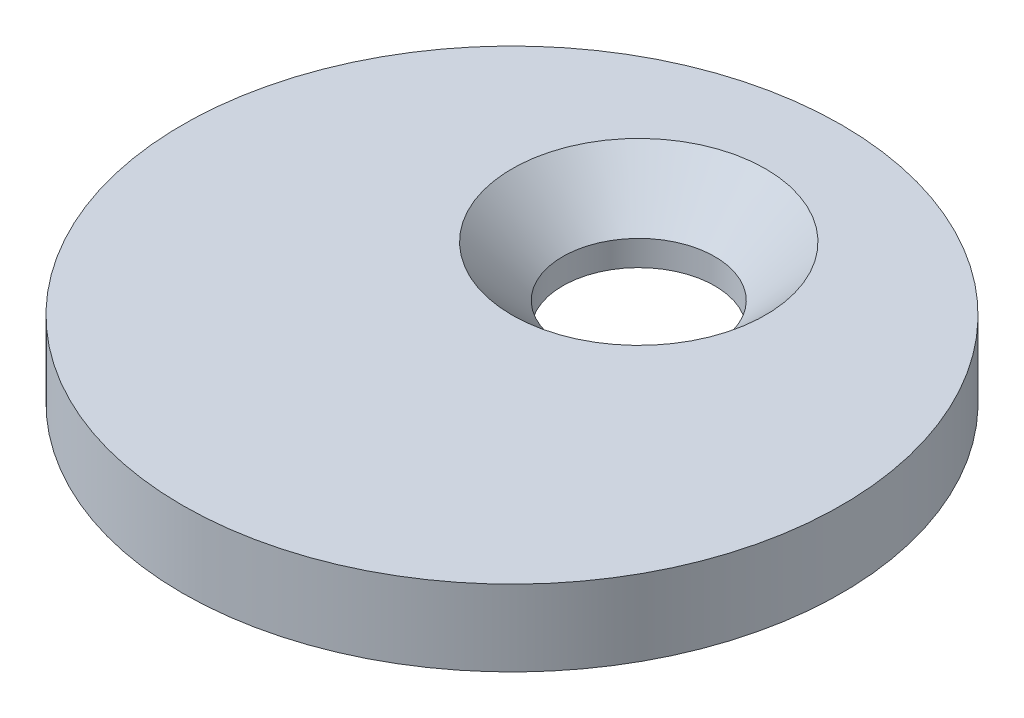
SolidWorks part; units mm, degrees
ref_plane "Front" through (0, 0, 0) normal (0, 0, 1) x (1, 0, 0)
ref_plane "Top" through (0, 0, 0) normal (0, 1, 0) x (1, 0, 0)
ref_plane "Right" through (0, 0, 0) normal (1, 0, 0) x (0, 0, -1)
sketch "Sketch1" plane through (0, 0, 0) normal (0, 1, 0) x (1, 0, 0)
  circle A0 centre (0, 0) radius 13
  circle A1 centre (0, 5) radius 3
extrude "Extrude1" add sketch "Sketch1" along normal blind 3
hole_wizard "CSK for M6 Countersunk Flat Head Screw1" positions "3DSketch1" profile "Sketch2" countersink size "M6" standard "ISO"
sketch3d "3DSketch1"
  line L0 (0, 3, -5) -> (0, 0, -5) construction
  point P0 (0, 3, -5)
sketch "Sketch2" plane through (0, 3, -5) normal (1, 0, 0) x (0, 0, 1)
  line L0 (0, 0) -> (0, 1.9026)
  line L1 (0, 1.9026) -> (3, 0.1)
  line L2 (3, 0.1) -> (3, 2)
  line L3 (3, 2) -> (5, 0)
  line L5 (5, 0) -> (0, 0)
  line L6 (-3, 2) -> (-5, 0) construction
  line L10 (0, 1.9026) -> (-3, 0.1) construction
  line L11 (0, -6.35) -> (0, 107.95) construction
  dimension "Hole Dia." = 6
  dimension "Hole Depth" = 0.1
  dimension "Near C'Sink Dia." = 10
  dimension "Near C'Sink Angle" = 90
  dimension "Drill Angle" = 118
